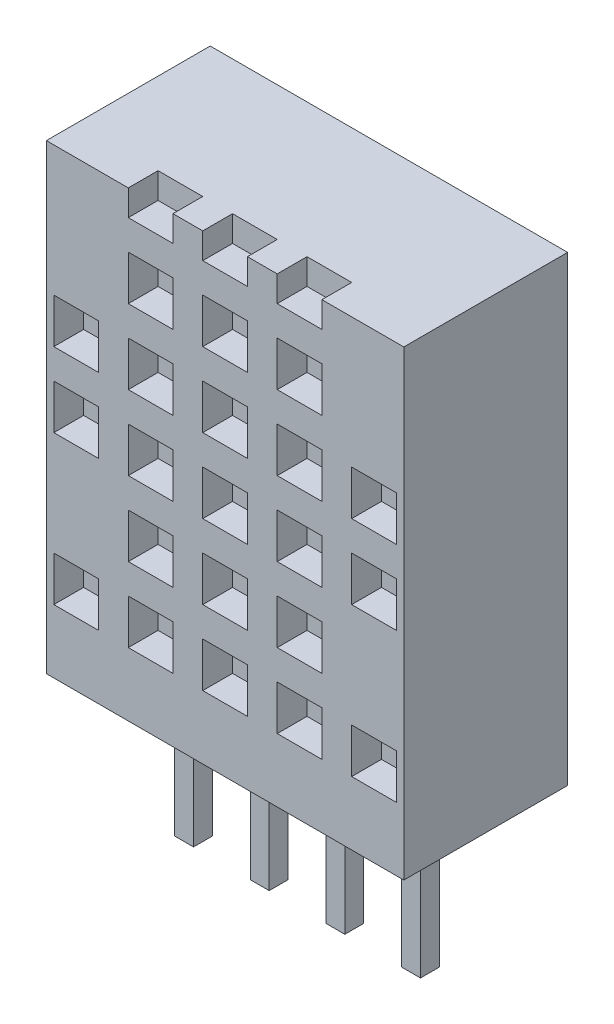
SolidWorks part; units mm, degrees
ref_plane "Front Plane" through (0, 0, 0) normal (0, 0, 1) x (1, 0, 0)
ref_plane "Top Plane" through (0, 0, 0) normal (0, 1, 0) x (1, 0, 0)
ref_plane "Right Plane" through (0, 0, 0) normal (1, 0, 0) x (0, 0, -1)
sketch "Sketch1" plane through (0, 0, 0) normal (0, 0, 1) x (1, 0, 0)
  line L1 (0, 0) -> (12, 0)
  line L2 (0, 0) -> (0, 15.5)
  line L3 (0, 15.5) -> (12, 15.5)
  line L4 (12, 0) -> (12, 15.5)
  dimension "D1" = 12
  dimension "D2" = 15.5
extrude "Body" add sketch "Sketch1" along normal blind 5.5
sketch "Sketch2" plane through (0, 0, 0) normal (0, -1, 0) x (1, 0, 0)
  line L0 (4.4125, 3.0675) -> (4.4125, 2.4325)
  line L1 (1.8725, 3.0675) -> (2.5075, 3.0675)
  line L2 (1.8725, 3.0675) -> (1.8725, 2.4325)
  line L3 (1.8725, 2.4325) -> (2.5075, 2.4325)
  line L4 (2.5075, 3.0675) -> (2.5075, 2.4325)
  line L5 (4.4125, 3.0675) -> (5.0475, 3.0675)
  line L6 (5.0475, 3.0675) -> (5.0475, 2.4325)
  line L7 (4.4125, 2.4325) -> (5.0475, 2.4325)
  line L8 (6.9525, 3.0675) -> (6.9525, 2.4325)
  line L9 (6.9525, 3.0675) -> (7.5875, 3.0675)
  line L10 (7.5875, 3.0675) -> (7.5875, 2.4325)
  line L11 (6.9525, 2.4325) -> (7.5875, 2.4325)
  line L12 (9.4925, 3.0675) -> (9.4925, 2.4325)
  line L13 (9.4925, 3.0675) -> (10.1275, 3.0675)
  line L14 (10.1275, 3.0675) -> (10.1275, 2.4325)
  line L15 (9.4925, 2.4325) -> (10.1275, 2.4325)
  line L16 (1.8725, 3.0675) -> (4.4125, 3.0675) construction
  line L17 (1.8725, 2.75) -> (10.1275, 2.75) construction
  line L18 (0, 0) -> (12, 0) construction
  line L19 (0, 5.5) -> (0, 0) construction
  point P20 (6, 2.75)
  point P23 (6, 0)
  point P26 (0, 2.75)
  dimension "D1" = 0.635
  dimension "D2" = 0.635
  dimension "D4" = 2.54
  dimension "D3" = 4
extrude "Pins" add sketch "Sketch2" along normal blind 5
sketch "Sketch3" plane through (0, 0, 5.5) normal (0, 0, 1) x (1, 0, 0)
  line L1 (0.25, 2.1342) -> (1.75, 2.1342)
  line L2 (0.25, 2.1342) -> (0.25, 3.6342)
  line L3 (0.25, 3.6342) -> (1.75, 3.6342)
  line L4 (1.75, 2.1342) -> (1.75, 3.6342)
  line L5 (2.75, 2.1342) -> (2.75, 3.6342)
  line L6 (2.75, 2.1342) -> (4.25, 2.1342)
  line L7 (4.25, 2.1342) -> (4.25, 3.6342)
  line L8 (2.75, 3.6342) -> (4.25, 3.6342)
  line L9 (5.25, 2.1342) -> (5.25, 3.6342)
  line L10 (5.25, 2.1342) -> (6.75, 2.1342)
  line L11 (6.75, 2.1342) -> (6.75, 3.6342)
  line L12 (5.25, 3.6342) -> (6.75, 3.6342)
  line L13 (7.75, 2.1342) -> (7.75, 3.6342)
  line L14 (7.75, 2.1342) -> (9.25, 2.1342)
  line L15 (9.25, 2.1342) -> (9.25, 3.6342)
  line L16 (7.75, 3.6342) -> (9.25, 3.6342)
  line L17 (10.25, 2.1342) -> (10.25, 3.6342)
  line L18 (10.25, 2.1342) -> (11.75, 2.1342)
  line L19 (11.75, 2.1342) -> (11.75, 3.6342)
  line L20 (10.25, 3.6342) -> (11.75, 3.6342)
  line L21 (2.75, 4.6342) -> (2.75, 6.1342)
  line L22 (2.75, 4.6342) -> (4.25, 4.6342)
  line L23 (4.25, 4.6342) -> (4.25, 6.1342)
  line L24 (2.75, 6.1342) -> (4.25, 6.1342)
  line L25 (5.25, 4.6342) -> (5.25, 6.1342)
  line L26 (5.25, 4.6342) -> (6.75, 4.6342)
  line L27 (6.75, 4.6342) -> (6.75, 6.1342)
  line L28 (5.25, 6.1342) -> (6.75, 6.1342)
  line L29 (7.75, 4.6342) -> (7.75, 6.1342)
  line L30 (7.75, 4.6342) -> (9.25, 4.6342)
  line L31 (9.25, 4.6342) -> (9.25, 6.1342)
  line L32 (7.75, 6.1342) -> (9.25, 6.1342)
  line L33 (10.25, 4.6342) -> (10.25, 6.1342)
  line L34 (10.25, 4.6342) -> (11.75, 4.6342)
  line L35 (11.75, 4.6342) -> (11.75, 6.1342)
  line L36 (10.25, 6.1342) -> (11.75, 6.1342)
  line L37 (2.75, 7.1342) -> (2.75, 8.6342)
  line L38 (2.75, 7.1342) -> (4.25, 7.1342)
  line L39 (4.25, 7.1342) -> (4.25, 8.6342)
  line L40 (2.75, 8.6342) -> (4.25, 8.6342)
  line L41 (5.25, 7.1342) -> (5.25, 8.6342)
  line L42 (5.25, 7.1342) -> (6.75, 7.1342)
  line L43 (6.75, 7.1342) -> (6.75, 8.6342)
  line L44 (5.25, 8.6342) -> (6.75, 8.6342)
  line L45 (7.75, 7.1342) -> (7.75, 8.6342)
  line L46 (7.75, 7.1342) -> (9.25, 7.1342)
  line L47 (9.25, 7.1342) -> (9.25, 8.6342)
  line L48 (7.75, 8.6342) -> (9.25, 8.6342)
  line L49 (10.25, 7.1342) -> (10.25, 8.6342)
  line L50 (10.25, 7.1342) -> (11.75, 7.1342)
  line L51 (11.75, 7.1342) -> (11.75, 8.6342)
  line L52 (10.25, 8.6342) -> (11.75, 8.6342)
  line L53 (2.75, 9.6342) -> (2.75, 11.1342)
  line L54 (2.75, 9.6342) -> (4.25, 9.6342)
  line L55 (4.25, 9.6342) -> (4.25, 11.1342)
  line L56 (2.75, 11.1342) -> (4.25, 11.1342)
  line L57 (5.25, 9.6342) -> (5.25, 11.1342)
  line L58 (5.25, 9.6342) -> (6.75, 9.6342)
  line L59 (6.75, 9.6342) -> (6.75, 11.1342)
  line L60 (5.25, 11.1342) -> (6.75, 11.1342)
  line L61 (7.75, 9.6342) -> (7.75, 11.1342)
  line L62 (7.75, 9.6342) -> (9.25, 9.6342)
  line L63 (9.25, 9.6342) -> (9.25, 11.1342)
  line L64 (7.75, 11.1342) -> (9.25, 11.1342)
  line L65 (10.25, 9.6342) -> (10.25, 11.1342)
  line L66 (10.25, 9.6342) -> (11.75, 9.6342)
  line L67 (11.75, 9.6342) -> (11.75, 11.1342)
  line L68 (10.25, 11.1342) -> (11.75, 11.1342)
  line L69 (2.75, 12.1342) -> (2.75, 13.6342)
  line L70 (2.75, 12.1342) -> (4.25, 12.1342)
  line L71 (4.25, 12.1342) -> (4.25, 13.6342)
  line L72 (2.75, 13.6342) -> (4.25, 13.6342)
  line L73 (5.25, 12.1342) -> (5.25, 13.6342)
  line L74 (5.25, 12.1342) -> (6.75, 12.1342)
  line L75 (6.75, 12.1342) -> (6.75, 13.6342)
  line L76 (5.25, 13.6342) -> (6.75, 13.6342)
  line L77 (7.75, 12.1342) -> (7.75, 13.6342)
  line L78 (7.75, 12.1342) -> (9.25, 12.1342)
  line L79 (9.25, 12.1342) -> (9.25, 13.6342)
  line L80 (7.75, 13.6342) -> (9.25, 13.6342)
  line L81 (10.25, 12.1342) -> (10.25, 13.6342)
  line L82 (10.25, 12.1342) -> (11.75, 12.1342)
  line L83 (11.75, 12.1342) -> (11.75, 13.6342)
  line L84 (10.25, 13.6342) -> (11.75, 13.6342)
  line L85 (2.75, 14.6342) -> (2.75, 16.1342)
  line L86 (2.75, 14.6342) -> (4.25, 14.6342)
  line L87 (4.25, 14.6342) -> (4.25, 16.1342)
  line L88 (2.75, 16.1342) -> (4.25, 16.1342)
  line L89 (5.25, 14.6342) -> (5.25, 16.1342)
  line L90 (5.25, 14.6342) -> (6.75, 14.6342)
  line L91 (6.75, 14.6342) -> (6.75, 16.1342)
  line L92 (5.25, 16.1342) -> (6.75, 16.1342)
  line L93 (7.75, 14.6342) -> (7.75, 16.1342)
  line L94 (7.75, 14.6342) -> (9.25, 14.6342)
  line L95 (9.25, 14.6342) -> (9.25, 16.1342)
  line L96 (7.75, 16.1342) -> (9.25, 16.1342)
  line L97 (10.25, 14.6342) -> (10.25, 16.1342)
  line L98 (10.25, 14.6342) -> (11.75, 14.6342)
  line L99 (11.75, 14.6342) -> (11.75, 16.1342)
  line L100 (10.25, 16.1342) -> (11.75, 16.1342)
  line L101 (0.25, 4.6342) -> (0.25, 6.1342)
  line L102 (0.25, 4.6342) -> (1.75, 4.6342)
  line L103 (1.75, 4.6342) -> (1.75, 6.1342)
  line L104 (0.25, 6.1342) -> (1.75, 6.1342)
  line L105 (0.25, 7.1342) -> (0.25, 8.6342)
  line L106 (0.25, 7.1342) -> (1.75, 7.1342)
  line L107 (1.75, 7.1342) -> (1.75, 8.6342)
  line L108 (0.25, 8.6342) -> (1.75, 8.6342)
  line L109 (0.25, 9.6342) -> (0.25, 11.1342)
  line L110 (0.25, 9.6342) -> (1.75, 9.6342)
  line L111 (1.75, 9.6342) -> (1.75, 11.1342)
  line L112 (0.25, 11.1342) -> (1.75, 11.1342)
  line L113 (0.25, 12.1342) -> (0.25, 13.6342)
  line L114 (0.25, 12.1342) -> (1.75, 12.1342)
  line L115 (1.75, 12.1342) -> (1.75, 13.6342)
  line L116 (0.25, 13.6342) -> (1.75, 13.6342)
  line L117 (0.25, 14.6342) -> (0.25, 16.1342)
  line L118 (0.25, 14.6342) -> (1.75, 14.6342)
  line L119 (1.75, 14.6342) -> (1.75, 16.1342)
  line L120 (0.25, 16.1342) -> (1.75, 16.1342)
  line L121 (0.25, 2.1342) -> (2.75, 2.1342) construction
  line L122 (0.25, 2.1342) -> (0.25, 4.6342) construction
  line L123 (12, 15.5) -> (0, 15.5) construction
  line L124 (0, 0) -> (12, 0) construction
  line L125 (6, 15.5) -> (6, 0) construction
  point P129 (6, 14.6342)
  dimension "D1" = 1.5
  dimension "D4" = 2.5
  dimension "D5" = 2.5
  dimension "D2" = 5
  dimension "D3" = 6
extrude "Cut-Extrude1" cut sketch "Sketch3" against normal blind 1
